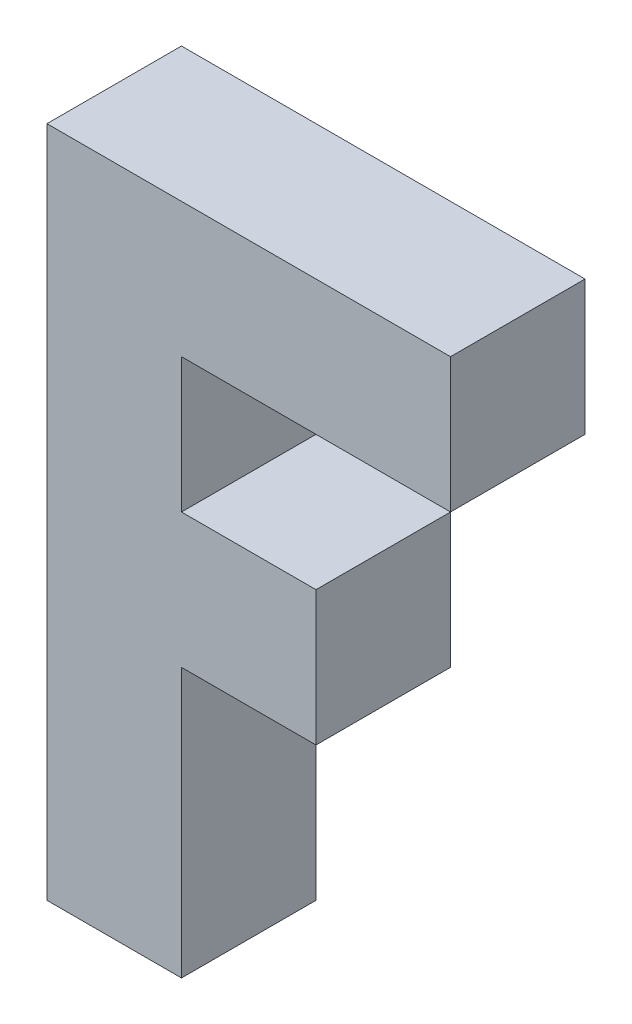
SolidWorks part; units mm, degrees
ref_plane "Plan de face" through (0, 0, 0) normal (0, 0, 1) x (1, 0, 0)
ref_plane "Plan de dessus" through (0, 0, 0) normal (0, 1, 0) x (1, 0, 0)
ref_plane "Plan de droite" through (0, 0, 0) normal (1, 0, 0) x (0, 0, -1)
sketch "Esquisse1" plane through (0, 0, 0) normal (0, 0, 1) x (1, 0, 0)
  line L0 (10, 30) -> (10, 40)
  line L1 (0, 0) -> (10, 0)
  line L2 (0, 0) -> (0, 50)
  line L3 (0, 50) -> (10, 50)
  line L4 (10, 0) -> (10, 20)
  line L5 (10, 50) -> (30, 50)
  line L7 (10, 40) -> (30, 40)
  line L8 (30, 50) -> (30, 40)
  line L9 (10, 30) -> (20, 30)
  line L11 (10, 20) -> (20, 20)
  line L12 (20, 30) -> (20, 20)
  dimension "D1" = 10
  dimension "D2" = 50
  dimension "D3" = 10
  dimension "D4" = 10
  dimension "D5" = 10
  dimension "D6" = 10
  dimension "D7" = 20
extrude "Boss.-Extru.1" add sketch "Esquisse1" along normal blind 10
